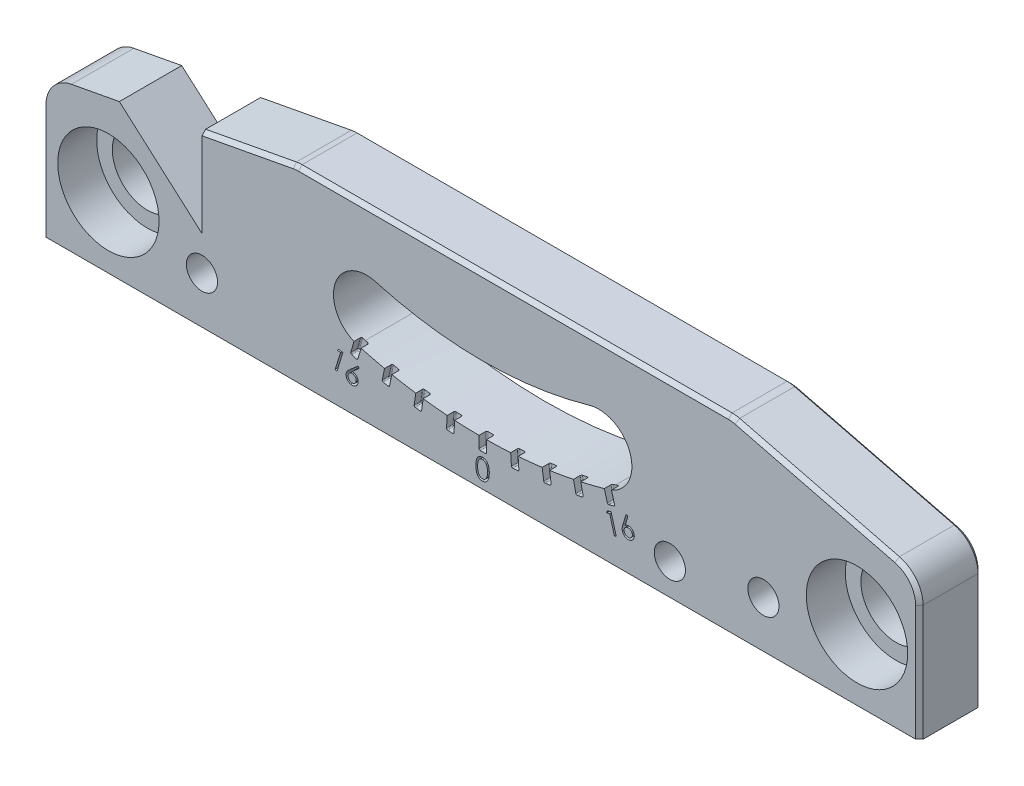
SolidWorks part; units mm, degrees
ref_plane "Front" through (0, 0, 0) normal (0, 0, 1) x (1, 0, 0)
ref_plane "Top" through (0, 0, 0) normal (0, 1, 0) x (1, 0, 0)
ref_plane "Right" through (0, 0, 0) normal (1, 0, 0) x (0, 0, -1)
sketch "Sketch1" plane through (0, 0, 0) normal (0, 0, 1) x (1, 0, 0)
  line L0 (0, 67.1585) -> (0, -46.3958) construction
  line L1 (44.45, 0) -> (-44.45, 0)
  line L2 (-44.45, 0) -> (-44.45, 19.05)
  line L3 (44.45, 0) -> (44.45, 19.05)
  line L4 (-44.45, 19.05) -> (44.45, 19.05)
  point P6 (0, 0)
  point P9 (0, 19.05)
  dimension "D1" = 88.9
  dimension "D2" = 19.05
extrude "Base-Extrude" add sketch "Sketch1" along normal blind 6.35
sketch "Sketch2" plane through (0, 0, 6.35) normal (0, 0, 1) x (1, 0, 0)
  line L0 (44.45, 14.2875) -> (25.4, 19.05)
  line L1 (44.45, 0) -> (44.45, 19.05) construction
  line L2 (-44.45, 19.05) -> (44.45, 19.05) construction
  line L3 (44.45, 0) -> (-44.45, 0) construction
  line L4 (25.4, 19.05) -> (44.45, 19.05)
  line L5 (44.45, 14.2875) -> (44.45, 19.05)
  dimension "D1" = 14.2875
  dimension "D2" = 19.05
extrude "Cut-Extrude1" cut sketch "Sketch2" against normal through all
sketch "Sketch4" plane through (0, 0, 6.35) normal (0, 0, 1) x (1, 0, 0)
  line L0 (-44.45, 14.2875) -> (-19.05, 19.05)
  line L1 (-44.45, 0) -> (-44.45, 19.05) construction
  line L2 (-44.45, 19.05) -> (25.4, 19.05) construction
  dimension "D1" = 25.4
extrude "Cut-Extrude3" cut sketch "Sketch4" against normal through all
sketch "Sketch5" plane through (0, 0, 6.35) normal (0, 0, 1) x (1, 0, 0)
  line L0 (-36.9844, 15.6873) -> (-28.575, 8.2623)
  line L1 (-44.45, 14.2875) -> (-19.05, 19.05) construction
  line L2 (-19.05, 19.05) -> (-30.473, 6.1126) construction
  line L3 (-28.575, 8.2623) -> (-28.575, 17.2641)
  line L4 (-36.9844, 15.6873) -> (-28.575, 17.2641)
  line L5 (0, 59.1462) -> (0, -3.4396) construction
  line L6 (0, -3.4925) -> (0, 3.4925) construction
  line L7 (44.45, 0) -> (-44.45, 0) construction
  point P6 (0, 50.8)
  dimension "D1" = 90
  dimension "D2" = 50.8
  dimension "D3" = 50.8
extrude "Cut-Extrude4" cut sketch "Sketch5" against normal through all
sketch "Sketch6" plane through (0, 0, 6.35) normal (0, 0, 1) x (1, 0, 0)
  line L0 (0, 50.8) -> (-14.5667, 0) construction
  line L1 (44.45, 0) -> (-44.45, 0) construction
  line L2 (0, 50.8) -> (14.5667, 0) construction
  line L3 (0, 65.7216) -> (0, 18.1985) construction
  line L4 (0, -3.4925) -> (0, 3.4925) construction
  arc A0 (-10.8847, 12.8407) -> (10.8847, 12.8407) centre (0, 50.8) ccw
  arc A2 (12.7444, 6.3552) -> (-12.7444, 6.3552) centre (0, 50.8) cw
  arc A3 (11.8145, 9.5979) -> (-11.8145, 9.5979) centre (0, 50.8) cw construction
  arc A4 (-12.7444, 6.3552) -> (-10.8847, 12.8407) centre (-11.8145, 9.5979) cw
  arc A5 (10.8847, 12.8407) -> (12.7444, 6.3552) centre (11.8145, 9.5979) cw
  point P16 (0, 11.3109)
  point P17 (0, 7.9375)
  point P18 (0, 4.5641)
  dimension "D2" = 42.8625
  dimension "D3" = 6.7469
  dimension "D1" = 32
  dimension "D4" = 3.3734
  dimension "D5" = 50.8
extrude "Cut-Extrude5" cut sketch "Sketch6" against normal through all
fillet "Fillet1" radius 3.175 4 edges at (44.45, 14.2875, 3.175) (25.4, 19.05, 3.175) (-19.05, 19.05, 3.175) (-44.45, 14.2875, 3.175)
hole_wizard "Hole1" positions "Sketch8" profile "Sketch9" legacy
sketch "Sketch8" plane through (0, 0, 6.35) normal (0, 0, 1) x (1, 0, 0)
  line L0 (0, -3.4925) -> (0, 3.4925) construction
  line L1 (44.45, 0) -> (-44.45, 0) construction
  point P0 (38.1, 7.1438)
  dimension "D1" = 38.1
  dimension "D2" = 7.1437
sketch "Sketch9" plane through (38.1, 7.1438, 6.35) normal (1, 0, 0) x (0, -1, 0)
  line L0 (0, 0) -> (0, 6.35)
  line L1 (0, 6.35) -> (3.5719, 6.35)
  line L2 (3.5719, 6.35) -> (3.5719, 3.9688)
  line L3 (3.5719, 3.9688) -> (5.1594, 3.9688)
  line L4 (5.1594, 3.9688) -> (5.1594, 0)
  line L5 (5.1594, 0) -> (0, 0)
  line L6 (0, 110) -> (0, -10) construction
pattern_linear "LPattern1" count 2 spacing 76.2 along (-1, 0, 0) of "Hole1"
other "Hole2"
sketch "Sketch10" plane through (0, 0, 6.35) normal (0, 0, 1) x (1, 0, 0)
  line L0 (44.45, 0) -> (-44.45, 0) construction
  line L1 (0, -3.4925) -> (0, 3.4925) construction
  circle A0 centre (28.575, 4.7625) radius 1.5875
  dimension "D1" = 3.175
  dimension "D2" = 4.7625
  dimension "D3" = 28.575
sketch "Sketch11" plane through (-6.4225, 2.9366, 6.35) normal (0, 0, 1) x (1, 0, 0)
  line L0 (50.8725, -2.9366) -> (-38.0275, -2.9366) construction
  line L1 (6.4225, -6.4291) -> (6.4225, 0.5559) construction
  circle A0 centre (25.4725, 0.2384) radius 1.5875
  dimension "D1" = 3.175
  dimension "D2" = 3.175
  dimension "D3" = 19.05
other "Hole3"
pattern_linear "LPattern2" count 2 spacing 57.15 along (-1, 0, 0) of "Hole2"
sketch "Sketch12" plane through (19.9492, 1.4866, 6.35) normal (0, 0, 1) x (1, 0, 0)
  line L0 (-19.9492, -1.4866) -> (-19.9492, 21.1407) construction
  line L1 (-20.3302, 1.809) -> (-20.3302, 4.349)
  line L2 (-19.5682, 1.809) -> (-19.5682, 4.349)
  line L3 (24.5008, -1.4866) -> (-64.3992, -1.4866) construction
  arc A2 (-32.3435, 6.0893) -> (-7.5549, 6.0893) centre (-19.9492, 49.3134) ccw
  arc A4 (-20.3302, 4.349) -> (-19.5682, 4.349) centre (-19.9492, 49.3134) ccw
  arc A5 (-33.0436, 3.6477) -> (-6.8548, 3.6477) centre (-19.9492, 49.3134) ccw
  arc A6 (-20.3302, 1.809) -> (-19.5682, 1.809) centre (-19.9492, 49.3134) ccw
  dimension "D3" = 1.27
  dimension "D4" = 1.27
extrude "notch" cut sketch "Sketch12" against normal blind 0.7937
fillet "Fillet4" radius 0.127 5 edges at (0, 3.2941, 5.5562) (0.381, 3.2956, 5.9531) (-0.381, 3.9306, 5.5562) (-0.381, 3.2956, 5.9531) (0.381, 3.9306, 5.5562)
pattern_circular "CirPattern1" count 5 every 4 about axis through (0, 50.8, 0) along (0, 0, 1) of "notch", "Fillet4"
mirror "Mirror1" about plane through (0, 0, 0) normal (1, 0, 0) of "CirPattern1", "Fillet4"
sketch "Sketch13" plane through (-3.8809, -10.8871, 6.35) normal (0, 0, 1) x (1, 0, 0)
  line L0 (3.8809, 0) -> (3.8809, 25.3851) construction
  arc A2 (0.8014, 11.736) -> (3.4685, 11.6429) centre (3.8809, 61.6871) ccw
  arc A3 (-11.8097, 14.1645) -> (19.5715, 14.1645) centre (3.8809, 61.6871) ccw construction
  text T0 "16" font "Century Gothic" height in points 8
  text T1 "0" font "Century Gothic" height in points 8
  text T2 "16" font "Century Gothic" height in points 8
  dimension "D1" = 3.81
extrude "limit_text" cut sketch "Sketch13" against normal blind 1.5875
chamfer "Chamfer1" distance 0.381 angle 45 14 edges at (-23.9575, 18.1298, 6.35) (44.45, 5.9043, 0) (33.9121, 16.922, 6.35) (3.1271, 19.05, 6.35) (25.3971, 19.0262, 6.35) (-19.0487, 19.0364, 6.35) (43.7776, 13.7625, 6.35) (33.9121, 16.922, 0) (-23.9575, 18.1298, 0) (3.1271, 19.05, 0) (25.3971, 19.0262, 0) (-19.0487, 19.0364, 0) (43.7776, 13.7625, 0) (44.45, 5.9043, 6.35)
